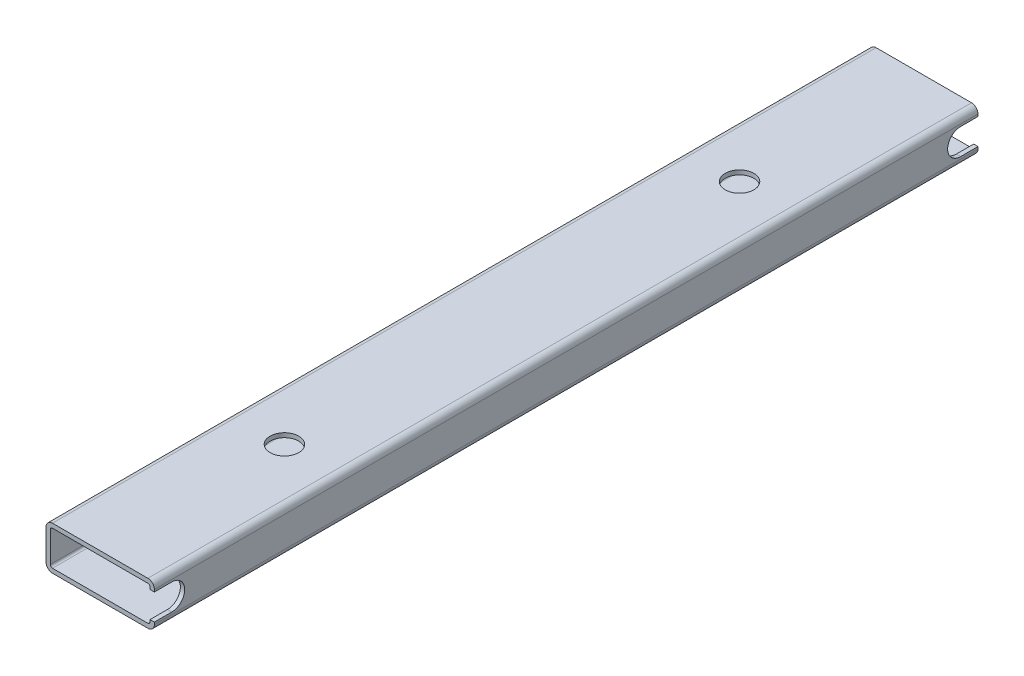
SolidWorks part; units mm, degrees
ref_plane "Plan de face" through (0, 0, 0) normal (0, 0, 1) x (1, 0, 0)
ref_plane "Plan de dessus" through (0, 0, 0) normal (0, 1, 0) x (1, 0, 0)
ref_plane "Plan de droite" through (0, 0, 0) normal (1, 0, 0) x (0, 0, -1)
sketch "Esquisse1" plane through (0, 0, 0) normal (0, 0, 1) x (1, 0, 0)
  line L0 (-11, 4) -> (11, 4)
  line L1 (-11, 5) -> (11, 5)
  line L2 (-12.5, 3.5) -> (-12.5, -3.5)
  line L3 (-11, -5) -> (11, -5)
  line L4 (12.5, 3.5) -> (12.5, -3.5)
  line L5 (-12.5, 5) -> (12.5, -5) construction
  line L6 (-12.5, -5) -> (12.5, 5) construction
  line L7 (11.5, 3.5) -> (11.5, -3.5)
  line L8 (-11, -4) -> (11, -4)
  line L9 (-11.5, 3.5) -> (-11.5, -3.5)
  arc A0 (-12.5, -3.5) -> (-11, -5) centre (-11, -3.5) ccw
  arc A1 (11, -5) -> (12.5, -3.5) centre (11, -3.5) ccw
  arc A2 (11, 5) -> (12.5, 3.5) centre (11, 3.5) cw
  arc A3 (-11, 5) -> (-12.5, 3.5) centre (-11, 3.5) ccw
  arc A4 (11, 4) -> (11.5, 3.5) centre (11, 3.5) cw
  arc A5 (11, -4) -> (11.5, -3.5) centre (11, -3.5) ccw
  arc A6 (-11.5, -3.5) -> (-11, -4) centre (-11, -3.5) ccw
  arc A7 (-11, 4) -> (-11.5, 3.5) centre (-11, 3.5) ccw
  point P0 (0, 0)
  dimension "D1" = 1.5
  dimension "D2" = 10
  dimension "D3" = 25
  dimension "D4" = 1
extrude "Boss.-Extru.1" add sketch "Esquisse1" along normal mid plane 190
hole_wizard "Dégagement M61" positions "Esquisse3" profile "Esquisse2" hole size "M6" standard "ISO"
sketch "Esquisse3" plane through (0, 5, 0) normal (0, 1, 0) x (1, 0, 0)
  line L0 (-21.2686, 0) -> (23.8115, 0) construction
  point P0 (0, -52.5)
  point P2 (0, 52.5)
  dimension "D1" = 105
sketch "Esquisse2" plane through (0, 5, 52.5) normal (1, 0, 0) x (0, 0, 1)
  line L0 (0, 0) -> (0, 10)
  line L1 (0, 10) -> (3.3, 10)
  line L2 (3.3, 10) -> (3.3, 0)
  line L5 (3.3, 0) -> (0, 0)
  line L11 (0, -6.35) -> (0, 107.95) construction
  dimension "Diamètre du perçage jusqu'au prochain" = 6.6
  dimension "Profondeur du perçage jusqu'au prochain" = 10
sketch "Esquisse4" plane through (12.5, 0, 0) normal (1, 0, 0) x (0, 0, -1)
  line L0 (-95, 3) -> (-91, 3)
  line L1 (-95, -3.5) -> (-95, 3.5) construction
  line L2 (-91, -3) -> (-95, -3)
  line L3 (-95, 3) -> (-95, -3)
  arc A0 (-91, 3) -> (-91, -3) centre (-91, 0) cw
  dimension "D1" = 3
  dimension "D2" = 4
extrude "Enlèv. mat.-Extru.2" cut sketch "Esquisse4" against normal up to next
mirror "Symétrie1" about plane through (0, 0, 0) normal (0, 0, 1) of "Enlèv. mat.-Extru.2"
